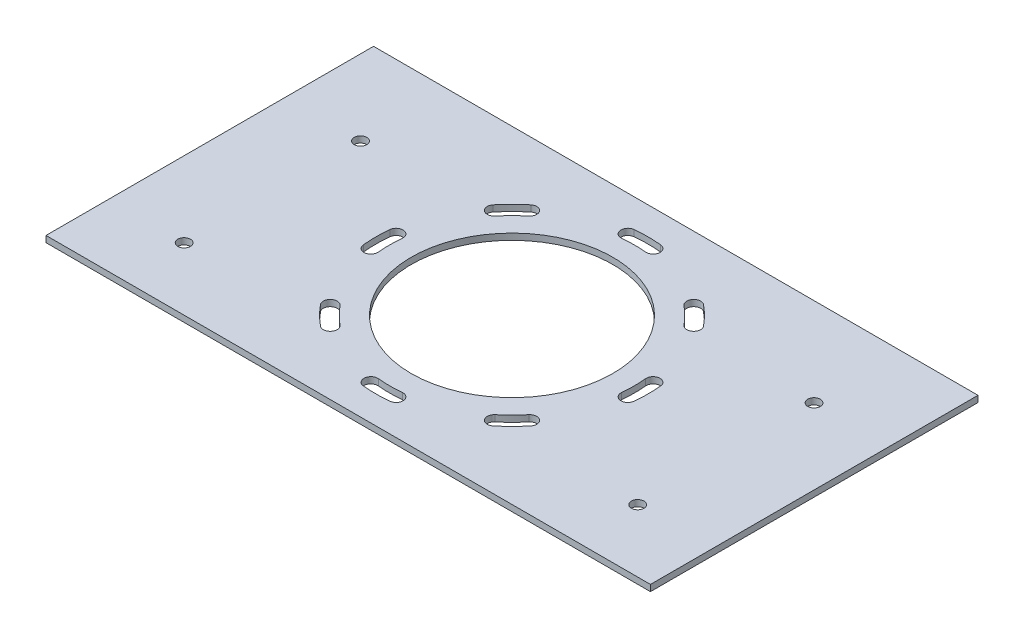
SolidWorks part; units mm, degrees
ref_plane "Front Plane" through (0, 0, 0) normal (0, 0, 1) x (1, 0, 0)
ref_plane "Top Plane" through (0, 0, 0) normal (0, 1, 0) x (1, 0, 0)
ref_plane "Right Plane" through (0, 0, 0) normal (1, 0, 0) x (0, 0, -1)
sketch "Sketch1" plane through (0, 402.2121, 0) normal (0, 1, 0) x (1, 0, 0)
  line L0 (-607.5404, -702.6158) -> (-607.5404, -1338.6392) construction
  line L1 (-912.2029, -1256.0892) -> (-607.5404, -1256.0892)
  line L2 (-912.2029, -1256.0892) -> (-912.2029, -1090.9892)
  line L3 (-912.2029, -1090.9892) -> (-607.5404, -1090.9892)
  line L4 (-607.5404, -1256.0892) -> (-607.5404, -1090.9892)
  circle A0 centre (-874.1716, -1135.6033) radius 3.175
  circle A1 centre (-874.1716, -1224.5033) radius 3.175
  circle A2 centre (-645.5716, -1224.5033) radius 3.175
  circle A3 centre (-645.5716, -1135.6033) radius 3.175
  dimension "D2" = 6.35
  dimension "D1" = 165.1
extrude "Boss-Extrude1" add sketch "Sketch1" along normal blind 3.175
sketch "Sketch2" plane through (0, 405.3871, 0) normal (0, 1, 0) x (1, 0, 0)
  line L0 (-759.8716, -1090.9892) -> (-759.8716, -1256.0892) construction
  line L1 (-607.5404, -1090.9892) -> (-912.2029, -1090.9892) construction
  line L2 (-912.2029, -1256.0892) -> (-607.5404, -1256.0892) construction
  line L3 (-912.2029, -1173.5392) -> (-607.5404, -1173.5392) construction
  line L4 (-912.2029, -1090.9892) -> (-912.2029, -1256.0892) construction
  line L5 (-607.5404, -1256.0892) -> (-607.5404, -1090.9892) construction
  line L6 (-759.8716, -1108.4503) -> (-759.8716, -1173.5392) construction
  circle A0 centre (-759.8716, -1173.5392) radius 65.0889 construction
  arc A1 (-766.2216, -1108.7607) -> (-753.5216, -1108.7607) centre (-759.8716, -1173.5392) cw construction
  arc A2 (-753.1809, -1105.2849) -> (-766.5623, -1105.2849) centre (-759.8716, -1173.5392) ccw
  arc A3 (-753.8623, -1112.2366) -> (-765.8809, -1112.2366) centre (-759.8716, -1173.5392) ccw
  arc A4 (-753.8623, -1112.2366) -> (-753.1809, -1105.2849) centre (-753.5216, -1108.7607) ccw
  arc A5 (-766.5623, -1105.2849) -> (-765.8809, -1112.2366) centre (-766.2216, -1108.7607) ccw
  arc A6 (-712.275, -1134.4409) -> (-720.7734, -1125.9425) centre (-759.8716, -1173.5392) ccw
  arc A7 (-712.275, -1134.4409) -> (-706.8775, -1130.0072) centre (-709.5762, -1132.224) ccw
  arc A8 (-716.3396, -1120.5451) -> (-720.7734, -1125.9425) centre (-718.5565, -1123.2438) ccw
  arc A9 (-706.8775, -1130.0072) -> (-716.3396, -1120.5451) centre (-759.8716, -1173.5392) ccw
  arc A10 (-718.5565, -1123.2438) -> (-709.5762, -1132.224) centre (-759.8716, -1173.5392) cw construction
  arc A11 (-698.5691, -1179.5484) -> (-698.5691, -1167.5299) centre (-759.8716, -1173.5392) ccw
  arc A12 (-698.5691, -1179.5484) -> (-691.6174, -1180.2299) centre (-695.0932, -1179.8892) ccw
  arc A13 (-691.6174, -1166.8484) -> (-698.5691, -1167.5299) centre (-695.0932, -1167.1892) ccw
  arc A14 (-691.6174, -1180.2299) -> (-691.6174, -1166.8484) centre (-759.8716, -1173.5392) ccw
  arc A15 (-695.0932, -1167.1892) -> (-695.0932, -1179.8892) centre (-759.8716, -1173.5392) cw construction
  arc A16 (-720.7734, -1221.1358) -> (-712.275, -1212.6374) centre (-759.8716, -1173.5392) ccw
  arc A17 (-720.7734, -1221.1358) -> (-716.3396, -1226.5332) centre (-718.5565, -1223.8345) ccw
  arc A18 (-706.8775, -1217.0711) -> (-712.275, -1212.6374) centre (-709.5762, -1214.8543) ccw
  arc A19 (-716.3396, -1226.5332) -> (-706.8775, -1217.0711) centre (-759.8716, -1173.5392) ccw
  arc A20 (-709.5762, -1214.8543) -> (-718.5565, -1223.8345) centre (-759.8716, -1173.5392) cw construction
  arc A21 (-765.8809, -1234.8417) -> (-753.8623, -1234.8417) centre (-759.8716, -1173.5392) ccw
  arc A22 (-765.8809, -1234.8417) -> (-766.5623, -1241.7934) centre (-766.2216, -1238.3176) ccw
  arc A23 (-753.1809, -1241.7934) -> (-753.8623, -1234.8417) centre (-753.5216, -1238.3176) ccw
  arc A24 (-766.5623, -1241.7934) -> (-753.1809, -1241.7934) centre (-759.8716, -1173.5392) ccw
  arc A25 (-753.5216, -1238.3176) -> (-766.2216, -1238.3176) centre (-759.8716, -1173.5392) cw construction
  arc A26 (-807.4683, -1212.6374) -> (-798.9699, -1221.1358) centre (-759.8716, -1173.5392) ccw
  arc A27 (-807.4683, -1212.6374) -> (-812.8657, -1217.0711) centre (-810.167, -1214.8543) ccw
  arc A28 (-803.4036, -1226.5332) -> (-798.9699, -1221.1358) centre (-801.1867, -1223.8345) ccw
  arc A29 (-812.8657, -1217.0711) -> (-803.4036, -1226.5332) centre (-759.8716, -1173.5392) ccw
  arc A30 (-801.1867, -1223.8345) -> (-810.167, -1214.8543) centre (-759.8716, -1173.5392) cw construction
  arc A31 (-821.1742, -1167.5299) -> (-821.1742, -1179.5484) centre (-759.8716, -1173.5392) ccw
  arc A32 (-821.1742, -1167.5299) -> (-828.1259, -1166.8484) centre (-824.65, -1167.1892) ccw
  arc A33 (-828.1259, -1180.2299) -> (-821.1742, -1179.5484) centre (-824.65, -1179.8892) ccw
  arc A34 (-828.1259, -1166.8484) -> (-828.1259, -1180.2299) centre (-759.8716, -1173.5392) ccw
  arc A35 (-824.65, -1179.8892) -> (-824.65, -1167.1892) centre (-759.8716, -1173.5392) cw construction
  arc A36 (-798.9699, -1125.9425) -> (-807.4683, -1134.4409) centre (-759.8716, -1173.5392) ccw
  arc A37 (-798.9699, -1125.9425) -> (-803.4036, -1120.5451) centre (-801.1867, -1123.2438) ccw
  arc A38 (-812.8657, -1130.0072) -> (-807.4683, -1134.4409) centre (-810.167, -1132.224) ccw
  arc A39 (-803.4036, -1120.5451) -> (-812.8657, -1130.0072) centre (-759.8716, -1173.5392) ccw
  arc A40 (-810.167, -1132.224) -> (-801.1867, -1123.2438) centre (-759.8716, -1173.5392) cw construction
  point P19 (-759.8716, -1108.4503)
  point P24 (-759.8716, -1173.5392)
  point P30 (-713.8468, -1127.5144)
  point P37 (-694.7827, -1173.5392)
  point P44 (-713.8468, -1219.564)
  point P51 (-759.8716, -1238.628)
  point P58 (-805.8964, -1219.564)
  point P65 (-824.9605, -1173.5392)
  point P72 (-805.8964, -1127.5144)
  dimension "D1" = 130.1778
  dimension "D2" = 6.35
  dimension "D3" = 6.985
  dimension "D4" = 8
extrude "Cut-Extrude1" cut sketch "Sketch2" against normal blind 3.175
sketch "Sketch3" plane through (0, 405.3871, 0) normal (0, 1, 0) x (1, 0, 0)
  line L0 (-759.8716, -1090.9892) -> (-759.8716, -1256.0892) construction
  line L1 (-607.5404, -1090.9892) -> (-912.2029, -1090.9892) construction
  line L2 (-912.2029, -1256.0892) -> (-607.5404, -1256.0892) construction
  circle A0 centre (-759.8716, -1173.5392) radius 50.8
  dimension "D1" = 101.6
extrude "Cut-Extrude2" cut sketch "Sketch3" against normal blind 3.175
